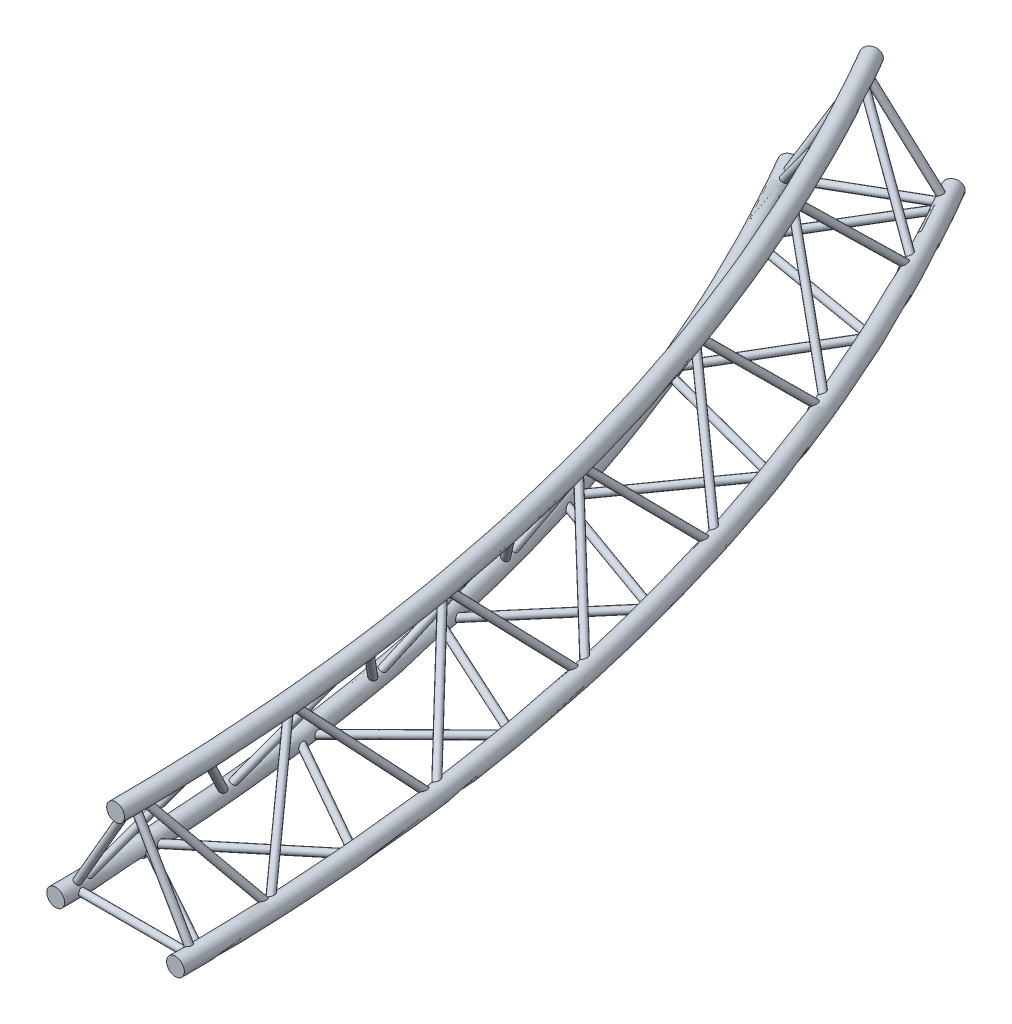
SolidWorks part; units mm, degrees
ref_plane "Face" through (0, 0, 0) normal (0, 0, 1) x (1, 0, 0)
ref_plane "Dessus" through (0, 0, 0) normal (0, 1, 0) x (1, 0, 0)
ref_plane "Droite" through (0, 0, 0) normal (1, 0, 0) x (0, 0, -1)
sketch "Esquisse1" plane through (0, 0, 0) normal (0, 0, 1) x (1, 0, 0)
  line L0 (5806.5, 194.567) -> (5638, -97.2835) construction
  line L1 (5638, -97.2835) -> (5975, -97.2835) construction
  line L2 (5975, -97.2835) -> (5806.5, 194.567) construction
  line L3 (5806.5, 61.5908) -> (5806.5, -61.5908) construction
  line L4 (72.9361, 0) -> (11540.0639, 0) construction
  line L5 (5806.5, 0) -> (5806.5, 194.567)
  line L8 (6000, -97.2835) -> (6000, 179.1091) construction
  line L9 (0, 252.4415) -> (0, -235.2114) construction
  circle A0 centre (5806.5, 0) radius 194.567 construction
  circle A1 centre (5806.5, 194.567) radius 25
  circle A2 centre (5638, -97.2835) radius 25
  circle A3 centre (5975, -97.2835) radius 25
  dimension "D1" = 90
  dimension "D2" = 50
  dimension "D3" = 337
  dimension "D4" = 6000
revolve "Révolution1" add sketch "Esquisse1" angle 30 about L9
ref_point "Point1"
ref_plane "Plan1" through (0, -97.2835, 0) normal (0, 1, 0) x (-1, 0, 0)
sketch "cercle1" plane through (0, -97.2835, 0) normal (0, 1, 0) x (-1, 0, 0)
  circle A0 centre (0, 0) radius 5638
ref_point "Point2"
ref_plane "Plan2" through (0, -97.2835, 0) normal (0, 1, 0) x (-1, 0, 0)
sketch "cercle2" plane through (0, -97.2835, 0) normal (0, 1, 0) x (-1, 0, 0)
  circle A0 centre (0, 0) radius 5975
ref_point "Point3"
ref_plane "Plan3" through (0, 194.567, 0) normal (0, 1, 0) x (-1, 0, 0)
sketch "cercle3" plane through (0, 194.567, 0) normal (0, 1, 0) x (-1, 0, 0)
  circle A0 centre (0, 0) radius 5806.5
ref_point "Point4"
ref_plane "Plan4" through (0, 0, 0) normal (0, 1, 0) x (-1, 0, 0)
sketch "cercle4" plane through (0, 0, 0) normal (0, 1, 0) x (-1, 0, 0)
  circle A0 centre (0, 0) radius 5806.5
ref_plane "plan_sym" through (0, 0, 0) normal (0.2588, 0, 0.9659) x (0.9659, 0, -0.2588)
sketch3d "Esquisse3D1"
  line L0 (5806.2847, 194.567, -49.9995) -> (5637.7783, -97.2835, -50)
  line L1 (5637.7783, -97.2835, -50) -> (5974.7908, -97.2835, -49.9996)
  line L2 (5974.7908, -97.2835, -49.9996) -> (5806.2847, 194.567, -49.9995)
  line L3 (5638, -97.2835, 0) -> (5975, -97.2835, 0) construction
  circle A0 centre (0, 194.567, 0) radius 5806.5 construction
  circle A1 centre (0, -97.2835, 0) radius 5638 construction
  circle A2 centre (0, -97.2835, 0) radius 5975 construction
  circle A3 centre (5806.5, 194.567, 0) radius 25 construction
  point P4 (0, 6001.067, 0)
  point P7 (0, 5540.7165, 0)
  point P11 (0, 5877.7165, 0)
  point P14 (5806.5, 194.567, 25)
  dimension "D1" = 50
  dimension "D2" = 50
  dimension "D3" = 50
ref_plane "Plan6" through (5637.7783, -97.2835, -50) normal (-0.5, -0.866, 0) x (0.866, -0.5, -0.0001)
sketch "Esquisse8" plane through (5637.7783, -97.2835, -50) normal (-0.5, -0.866, 0) x (0.866, -0.5, -0.0001)
  circle A0 centre (0, 0) radius 10
  dimension "D1" = 20
sweep "treilli droit départ" add profiles "Esquisse8" path "Esquisse3D1"
mirror "treilli droit fin" about plane through (0, 0, 0) normal (0.2588, 0, 0.9659) of "treilli droit départ"
sketch3d "Esquisse3D2"
  line L0 (5974.59, -97.2835, -69.9988) -> (5632.0035, -97.2835, -259.963)
  line L1 (5638, -97.2835, 0) -> (5975, -97.2835, 0) construction
  circle A0 centre (0, -97.2835, 0) radius 5975 construction
  circle A1 centre (0, -97.2835, 0) radius 5638 construction
  point P4 (0, 5877.7165, 0)
  point P7 (0, 5540.7165, 0)
  dimension "D1" = 70
  dimension "D2" = 259.963
ref_plane "Plan7" through (5632.0035, -97.2835, -259.963) normal (-0.8745, 0, -0.4849) x (-0.4849, 0, 0.8745)
sketch "Esquisse9" plane through (5632.0035, -97.2835, -259.963) normal (-0.8745, 0, -0.4849) x (-0.4849, 0, 0.8745)
  circle A0 centre (0, 0) radius 10
  dimension "D1" = 20
sweep "treilli depart 1" add profiles "Esquisse9" path "Esquisse3D2"
sketch3d "Esquisse3D3"
  line L0 (5637.5654, -97.2835, -69.9987) -> (5800.6806, 194.567, -259.8979)
  circle A0 centre (0, -97.2835, 0) radius 5638 construction
  circle A1 centre (0, 194.567, 0) radius 5806.5 construction
  point P4 (0, 5540.7165, 0)
  point P7 (0, 6001.067, 0)
  dimension "D1" = 70
  dimension "D2" = 259.963
ref_plane "Plan8" through (5637.5654, -97.2835, -69.9987) normal (0.4242, 0.759, -0.4939) x (-0.9055, 0.3476, -0.2436)
sketch "Esquisse10" plane through (5637.5654, -97.2835, -69.9987) normal (0.4242, 0.759, -0.4939) x (-0.9055, 0.3476, -0.2436)
  circle A0 centre (0, 0) radius 10
  dimension "D1" = 20
sweep "treilli depart 2" add profiles "Esquisse10" path "Esquisse3D3"
sketch3d "Esquisse3D4"
  line L0 (5806.0781, 194.567, -69.9987) -> (5968.4411, -97.2835, -279.8862)
  circle A0 centre (0, 194.567, 0) radius 5806.5 construction
  circle A1 centre (0, -97.2835, 0) radius 5975 construction
  point P4 (0, 6001.067, 0)
  point P7 (0, 5877.7165, 0)
  dimension "D1" = 279.963
  dimension "D2" = 70
ref_plane "Plan9" through (5968.4411, -97.2835, -279.8862) normal (0.4116, -0.7399, -0.5321) x (0.9114, 0.3354, 0.2386)
sketch "Esquisse11" plane through (5968.4411, -97.2835, -279.8862) normal (0.4116, -0.7399, -0.5321) x (0.9114, 0.3354, 0.2386)
  circle A0 centre (0, 0) radius 10
  dimension "D1" = 20
sweep "treilli depart 3" add profiles "Esquisse11" path "Esquisse3D4"
mirror "treillis fin" about plane through (0, 0, 0) normal (0.2588, 0, 0.9659) of "treilli depart 1", "treilli depart 2", "treilli depart 3"
sketch3d "Esquisse3D6"
  line L0 (5800.6806, 194.567, -259.8979) -> (5616.1841, -97.2835, -495.4998)
  line L1 (5786.4947, 169.1852, -243.3826) -> (5647.4395, -79.6166, -81.494) construction
  circle A0 centre (0, 194.567, 0) radius 5806.5 construction
  circle A1 centre (0, -97.2835, 0) radius 5638 construction
  point P4 (0, 6001.067, 0)
  point P7 (0, 5540.7165, 0)
  dimension "D1" = 418
ref_plane "Plan11" through (5616.1841, -97.2835, -495.4998) normal (-0.4414, -0.6982, -0.5636) x (0.8961, -0.3753, -0.2369)
sketch "Esquisse12" plane through (5616.1841, -97.2835, -495.4998) normal (-0.4414, -0.6982, -0.5636) x (0.8961, -0.3753, -0.2369)
  circle A0 centre (0, 0) radius 10
  dimension "D1" = 20
sweep "treilli int 1" add profiles "Esquisse12" path "Esquisse3D6"
ref_plane "Plan10" through (0, 0, 0) normal (0.0879, 0, 0.9961) x (0.9961, 0, -0.0879)
sketch3d "Esquisse3D7"
  line L2 (5968.8325, -97.2835, -271.411) -> (5784.0321, 194.567, -510.3086)
  circle A0 centre (0, 194.567, 0) radius 5806.5 construction
  circle A1 centre (0, -97.2835, 0) radius 5975 construction
  point P4 (0, 6001.067, 0)
  point P5 (0, 5877.7165, 0)
  dimension "D1" = 420
ref_plane "Plan12" through (5784.0321, 194.567, -510.3086) normal (-0.44, 0.6949, -0.5688) x (-0.8777, -0.1989, 0.436)
sketch "Esquisse13" plane through (5784.0321, 194.567, -510.3086) normal (-0.44, 0.6949, -0.5688) x (-0.8777, -0.1989, 0.436)
  circle A0 centre (0, 0) radius 10
  dimension "D1" = 20
sweep "treilli int 2" add profiles "Esquisse13" path "Esquisse3D7"
sketch3d "Esquisse3D9"
  line L0 (5632.0035, -97.2835, -259.963) -> (5951.8801, -97.2835, -525.1173)
  line L1 (5954.2705, -97.2835, -81.266) -> (5661.323, -97.2835, -243.7053) construction
  circle A0 centre (0, -97.2835, 0) radius 5638 construction
  circle A1 centre (0, -97.2835, 0) radius 5975 construction
  point P4 (0, 5540.7165, 0)
  point P7 (0, 5877.7165, 0)
  dimension "D1" = 415.4851
ref_plane "Plan13" through (5632.0035, -97.2835, -259.963) normal (0.7699, 0, -0.6382) x (-0.6382, 0, -0.7699)
sketch "Esquisse14" plane through (5632.0035, -97.2835, -259.963) normal (0.7699, 0, -0.6382) x (-0.6382, 0, -0.7699)
  circle A0 centre (0, 0) radius 10
  dimension "D1" = 20
sweep "treilli int 3" add profiles "Esquisse14" path "Esquisse3D9"
sketch3d "Esquisse3D10"
  line L0 (5756.5787, 194.567, -759.766) -> (5616.1841, -97.2835, -495.4998)
  circle A0 centre (0, 194.567, 0) radius 5806.5 construction
  circle A1 centre (0, -97.2835, 0) radius 5638 construction
  point P4 (0, 6001.067, 0)
  point P7 (0, 5540.7165, 0)
  dimension "D1" = 418
ref_plane "Plan14" through (5756.5787, 194.567, -759.766) normal (-0.3359, -0.6982, 0.6322) x (0.9117, -0.0725, 0.4043)
sketch "Esquisse15" plane through (5756.5787, 194.567, -759.766) normal (-0.3359, -0.6982, 0.6322) x (0.9117, -0.0725, 0.4043)
  circle A0 centre (0, 0) radius 10
  dimension "D1" = 20
sweep "treilli int4" add profiles "Esquisse15" path "Esquisse3D10"
sketch3d "Esquisse3D11"
  line L0 (5784.0321, 194.567, -510.3086) -> (5924.1488, -97.2835, -777.8727)
  circle A0 centre (0, -97.2835, 0) radius 5975 construction
  point P5 (0, 5877.7165, 0)
  dimension "D1" = 420
ref_plane "Plan15" through (5924.1488, -97.2835, -777.8727) normal (0.3336, -0.6949, -0.6371) x (-0.9158, -0.0787, -0.3938)
sketch "Esquisse16" plane through (5924.1488, -97.2835, -777.8727) normal (0.3336, -0.6949, -0.6371) x (-0.9158, -0.0787, -0.3938)
  circle A0 centre (0, 0) radius 10
  dimension "D1" = 20
sweep "treilli int 5" add profiles "Esquisse16" path "Esquisse3D11"
sketch3d "Esquisse3D12"
  line L0 (5951.8801, -97.2835, -525.1173) -> (5590.5186, -97.2835, -730.168)
  circle A0 centre (0, -97.2835, 0) radius 5638 construction
  point P5 (0, 5540.7165, 0)
  dimension "D1" = 415.4851
ref_plane "Plan16" through (5951.8801, -97.2835, -525.1173) normal (-0.8697, 0, -0.4935) x (-0.4935, 0, 0.8697)
sketch "Esquisse17" plane through (5951.8801, -97.2835, -525.1173) normal (-0.8697, 0, -0.4935) x (-0.4935, 0, 0.8697)
  circle A0 centre (0, 0) radius 10
  dimension "D1" = 20
sweep "treilli int 6" add profiles "Esquisse17" path "Esquisse3D12"
sketch "Esquisse19" plane through (0, 0, 0) normal (0, 1, 0) x (1, 0, 0)
  line L0 (5616.1841, 495.4998) -> (0, 0)
  line L1 (0, 0) -> (5800.6806, 259.8979)
  line L2 (5786.4947, 243.3826) -> (5647.4395, 81.494) construction
  line L3 (-267.1713, -23.5718) -> (267.1713, 23.5718) construction
  line L4 (5790.259, 273.2062) -> (5631.4669, 475.9838) construction
  circle A1 centre (0, 0) radius 5638 construction
  circle A2 centre (0, 0) radius 5806.5 construction
  dimension "D1" = 2.477
pattern_circular "Répétition circulaire1" count 5 every 4.953 of "treilli int 1", "treilli int 3", "treilli int 2"
pattern_circular "Répétition circulaire2" count 5 every 4.953 of "treilli int4", "treilli int 6", "treilli int 5"
sketch3d "Esquisse3D13"
  line L0 (5063.2111, 194.567, -2842.4172) -> (5007.4396, -97.2835, -2590.8672)
  circle A0 centre (0, 194.567, 0) radius 5806.5 construction
  circle A1 centre (0, -97.2835, 0) radius 5638 construction
  point P4 (0, 6001.067, 0)
  point P7 (0, 5540.7165, 0)
  dimension "D1" = 259.963
  dimension "D2" = 70
ref_plane "Plan17" through (5063.2111, 194.567, -2842.4172) normal (-0.1433, -0.7497, 0.6461) x (0.7291, 0.3616, 0.5811)
sketch "Esquisse21" plane through (5063.2111, 194.567, -2842.4172) normal (-0.1433, -0.7497, 0.6461) x (0.7291, 0.3616, 0.5811)
  circle A0 centre (0, 0) radius 10
  dimension "D1" = 20
sweep "treilli sym 1" [suppressed] add profiles "Esquisse21" path "Esquisse3D13"
sketch3d "Esquisse3D14"
  line L0 (5162.7096, 194.567, -2657.4183) -> (5209.1467, -97.2835, -2926.6732)
  circle A0 centre (0, 194.567, 0) radius 5806.5 construction
  circle A1 centre (0, -97.2835, 0) radius 5975 construction
  point P4 (0, 6001.067, 0)
  point P7 (0, 5877.7165, 0)
  dimension "D1" = 70
  dimension "D2" = 279.963
ref_plane "Plan18" [suppressed] through (2859.8111, -97.2835, -2760.8161) normal (-0.0514, -0.7303, -0.6812) x (0.8263, -0.4142, 0.3816)
sketch "Esquisse22" [suppressed] plane through (2859.8111, -97.2835, -2760.8161) normal (-0.0514, -0.7303, -0.6812) x (0.8263, -0.4142, 0.3816)
  circle A0 centre (-5.0885, 0) radius 10
  dimension "D1" = 20
sweep "treilli sym 2" [suppressed] add profiles "Esquisse22" path "Esquisse3D14"
sketch3d "Esquisse3D15"
  line L0 (5039.6534, -97.2835, -3209.7536) -> (4917.2749, -97.2835, -2758.1609)
  circle A0 centre (0, -97.2835, 0) radius 5975 construction
  circle A1 centre (0, -97.2835, 0) radius 5638 construction
  circle A3 centre (5174.5018, -97.2835, -2987.5) radius 25 construction
  point P4 (0, 5877.7165, 0)
  point P7 (0, 5540.7165, 0)
  point P13 (5187.0018, -97.2835, -2965.8494)
  dimension "D1" = 70
  dimension "D2" = 259.963
ref_plane "Plan19" [suppressed] through (2986.5368, -97.2835, -2623.2085) normal (-0.964, 0, 0.266) x (0.266, 0, 0.964)
sketch "Esquisse23" [suppressed] plane through (2986.5368, -97.2835, -2623.2085) normal (-0.964, 0, 0.266) x (0.266, 0, 0.964)
  circle A0 centre (0, 0) radius 10
  dimension "D1" = 20
sweep "treilli sym 3" [suppressed] add profiles "Esquisse23" path "Esquisse3D15"
equation "\"D1@plan_sym\"=\"D1@Révolution1\"/2"
equation "\"pas_theorique\"=500"
equation "\"demi_pas_theorique\"=\"pas_theorique\"/2"
equation "\"nb_demi_pas_theorique\"=(2*\"D4@Esquisse1\"* pi -2*70)/(\"demi_pas_theorique\")"
equation "\"nb_arche\"=360/\"D1@Révolution1\""
equation "\"nb_demi_pas_th_2\"=\"nb_demi_pas_theorique\"/\"nb_arche\""
equation "\"nb_demi_pas_entier\"=int(\"nb_demi_pas_th_2\")-1"
equation "\"D2@Esquisse3D2\" = 70+(\"nb_demi_pas_th_2\"-\"nb_demi_pas_entier\")*\"pas_theorique\"/4"
equation "\"D2@Esquisse3D3\" = \"D2@Esquisse3D2\""
equation "\"D1@Esquisse3D4\"=\"D2@Esquisse3D2\"+20"
equation "\"D1@Esquisse3D10\" = \"D1@Esquisse3D6\""
equation "\"D1@Esquisse3D11\" = \"D1@Esquisse3D7\""
equation "\"D1@Esquisse3D12\" = \"D1@Esquisse3D9\""
equation "\"D2@Répétition circulaire1\"=\"D1@Esquisse19\"*2"
equation "\"D1@Esquisse3D13\" = \"D2@Esquisse3D2\""
equation "\"D2@Esquisse3D14\" = \"D1@Esquisse3D4\""
equation "\"D2@Esquisse3D15\" = \"D2@Esquisse3D3\""
equation "\"D2@Répétition circulaire2\" = \"D1@Esquisse19\"*2"
